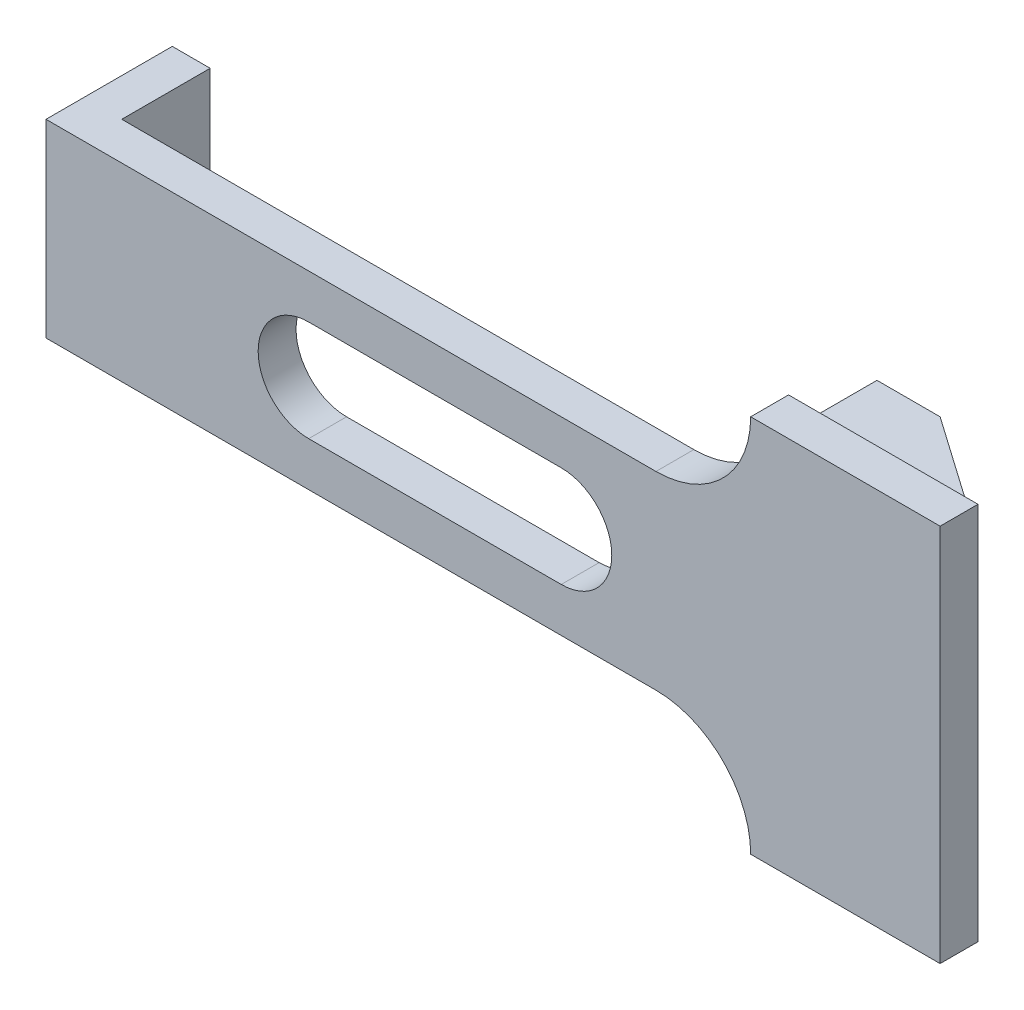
SolidWorks part; units mm, degrees
ref_plane "Ebene vorne" through (0, 0, 0) normal (0, 0, 1) x (1, 0, 0)
ref_plane "Ebene oben" through (0, 0, 0) normal (0, 1, 0) x (1, 0, 0)
ref_plane "Ebene rechts" through (0, 0, 0) normal (1, 0, 0) x (0, 0, -1)
sketch "Skizze1" plane through (0, 0, 0) normal (0, 1, 0) x (1, 0, 0)
  line L0 (0, 0) -> (70.8, 0)
  line L1 (70.8, 0) -> (70.8, 3)
  line L2 (70.8, 3) -> (60.8, 10)
  line L3 (60.8, 10) -> (55.8, 10)
  line L4 (55.8, 10) -> (55.8, 3)
  line L5 (55.8, 3) -> (3, 3)
  line L6 (3, 3) -> (3, 10)
  line L7 (3, 10) -> (0, 10)
  line L8 (0, 10) -> (0, 0)
  dimension "D1" = 70.8
  dimension "D2" = 3
  dimension "D3" = 5
  dimension "D4" = 15
  dimension "D5" = 10
  dimension "D6" = 3
  dimension "D7" = 3
  dimension "D8" = 10
extrude "Linear austragen1" add sketch "Skizze1" along normal mid plane 30
sketch "Skizze2" plane through (0, 0, 0) normal (0, 0, 1) x (1, 0, 0)
  line L0 (0, 7.5) -> (48.3, 7.5)
  line L1 (0, 15) -> (0, -15) construction
  line L4 (0, 15) -> (70.8, 15) construction
  line L5 (55.8, 15) -> (0, 15)
  line L6 (0, 15) -> (0, 7.5)
  arc A1 (48.3, 7.5) -> (55.8, 15) centre (48.3, 15) ccw
  dimension "D3" = 48.3
  dimension "D1" = 7.5
  dimension "D4" = 55.8
extrude "Linear austragen2" cut sketch "Skizze2" against normal through all
mirror "Spiegeln1" about plane through (0, 0, 0) normal (0, 1, 0) of "Linear austragen2"
sketch "Skizze3" plane through (0, 0, 0) normal (0, 0, 1) x (1, 0, 0)
  line L0 (20.8, 0) -> (40.8, 0) construction
  line L1 (5.5, 0) -> (-5.5, 0) construction
  line L2 (20.8, 4) -> (40.8, 4)
  line L3 (20.8, -4) -> (40.8, -4)
  line L4 (70.8, 15) -> (70.8, -15) construction
  arc A0 (20.8, 4) -> (20.8, -4) centre (20.8, 0) ccw
  arc A1 (40.8, -4) -> (40.8, 4) centre (40.8, 0) ccw
  point P5 (30.8, 0)
  dimension "D1" = 20
  dimension "D2" = 30
  dimension "D3" = 8
extrude "Langloch" cut sketch "Skizze3" against normal blind 30
ref_plane "Ebene1" through (70.8, 0, 0) normal (1, 0, 0) x (0, 0, -1)
sketch "Skizze4" plane through (70.8, 0, 0) normal (1, 0, 0) x (0, 0, -1)
  line L0 (3, 15) -> (3, -15) construction
  line L1 (10, 15) -> (3, 15)
  line L2 (10, 15) -> (10, 12.5)
  line L3 (10, 12.5) -> (3, 12.5)
  line L4 (3, 15) -> (3, 12.5)
  line L6 (10, -15) -> (3, -15)
  line L7 (10, -15) -> (10, -12.5)
  line L8 (10, -12.5) -> (3, -12.5)
  line L9 (3, -15) -> (3, -12.5)
  dimension "D1" = 2.5
  dimension "D2" = 2.5
extrude "Linear austragen4" cut sketch "Skizze4" against normal up to next
